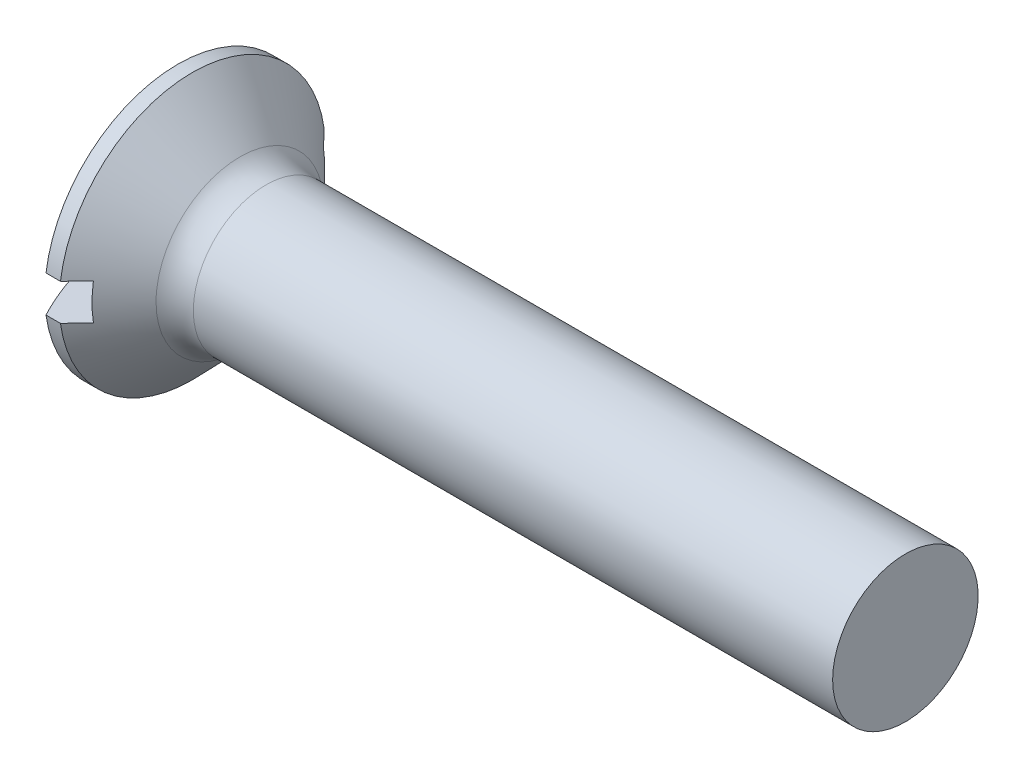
SolidWorks part; units mm, degrees
ref_plane "Plane1" through (0, 0, 0) normal (0, 0, 1) x (1, 0, 0)
ref_plane "Plane2" through (0, 0, 0) normal (0, 1, 0) x (1, 0, 0)
ref_plane "Plane3" through (0, 0, 0) normal (1, 0, 0) x (0, 0, -1)
sketch "BodySke" plane through (0, 0, 0) normal (0, 0, 1) x (1, 0, 0)
  line L0 (0, 0) -> (52.3, 0)
  line L1 (52.3, 0) -> (52.3, 5)
  line L2 (52.3, 5) -> (7.3, 5)
  line L3 (3.2924, -9.15) -> (7.3, -5) construction
  line L4 (-15.875, 0) -> (82.55, 0) construction
  line L5 (3.2924, 9.15) -> (7.3, 5)
  line L6 (8.8, 8.175) -> (8.8, -7.7) construction
  line L7 (2.3, 2.7793) -> (2.3, -13.0957) construction
  line L8 (3.2924, 9.15) -> (2.3, 9.15)
  arc A0 (0, 0) -> (2.3, 9.15) centre (19.3505, 0) cw
  dimension "Length" = 50
  dimension "Diameter" = 10
  dimension "Head_dia" = 18.3
  dimension "Head_ang" = 92
  dimension "Advance" = 1.5
  dimension "Thread_nom" = 50
  dimension "Oval_ht" = 2.3
  dimension "Side_ht" = 5
revolve "Base-Revolve" add sketch "BodySke"
extrude "Slot" cut sketch "Sketch2" along normal blind 4.4
sketch "Sketch2" plane through (0, 0, 0) normal (1, 0, 0) x (0, 0, -1)
  line L0 (9.15, -1.25) -> (-9.15, -1.25)
  line L1 (9.15, -1.25) -> (9.15, 1.25)
  line L2 (-9.15, 1.25) -> (9.15, 1.25)
  line L3 (-9.15, 1.25) -> (-9.15, -1.25)
  dimension "D1" = 18.3
  dimension "Slot_width" = 2.5
  dimension "D3" = 9.15
  dimension "D4" = 1.25
fillet "Fillet1" radius 2.5 1 edges at (7.3, 0, 5)
sketch "ThdSchSke" plane through (0, 0, 0) normal (0, 0, 1) x (1, 0, 0)
  line L0 (8.8, -4.172) -> (8.2202, -5)
  line L1 (8.8, -4.172) -> (9.3798, -5)
  line L2 (9.3798, -5) -> (9.3798, -6.25)
  line L3 (-3.175, 0) -> (5.1513, 0) construction
  line L5 (9.3798, -6.25) -> (8.2202, -6.25)
  line L6 (8.2202, -6.25) -> (8.2202, -5)
  dimension "Thread_minor" = 8.344
  dimension "Diameter" = 10
  dimension "Start" = 8.8
  dimension "SideAngle" = 55
  dimension "VeeAngle" = 70
  dimension "Overcut" = 12.5
revolve "ThreadSchematic" [suppressed] cut sketch "ThdSchSke" angle 360 about L3
pattern_linear "ThdSchPat" [suppressed]
equation "\"D1@Sketch2\" = \"Head_dia@BodySke\""
equation "\"D3@Sketch2\" = \"D1@Sketch2\" / 2"
equation "\"D4@Sketch2\" = \"Slot_width@Sketch2\" / 2"
equation "\"Thread_length@ThreadCosmetic\" = ((sgn( (\"Length@BodySke\" - \"Advance@BodySke\" - \"Side_ht@BodySke\" ) - \"Thread_nom@BodySke\" )-1)*( (\"Length@BodySke\" - \"Advance@BodySke\" - \"Side_ht@BodySke\" ) - \"Thread_"
equation "\"Thread_minor@ThdSchSke\" = \"Thread_minor@ThreadCosmetic\""
equation "\"Diameter@ThdSchSke\" = \"Diameter@BodySke\""
equation "\"Overcut@ThdSchSke\" = \"Diameter@BodySke\" * 1.25"
equation "\"Start@ThdSchSke\" = \"Oval_ht@BodySke\" + \"Length@BodySke\" - \"Thread_length@ThreadCosmetic\"  '---Countersunk---"
equation "\"Num_threads@ThdSchPat\" = int( \"Thread_length@ThreadCosmetic\" / \"Advance@BodySke\" + 0.999 )  + 1"
equation "\"Advance@ThdSchPat\" = \"Thread_length@ThreadCosmetic\" /  (\"Num_threads@ThdSchPat\" - 1) 'relax it"
